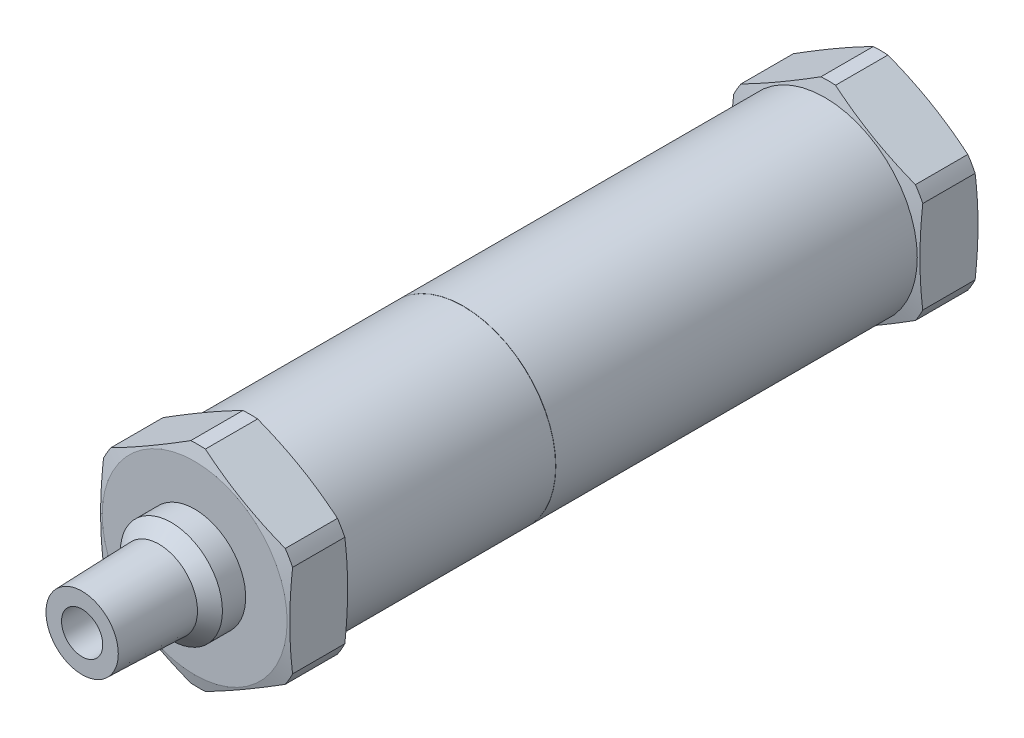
SolidWorks part; units mm, degrees
ref_plane "Front Plane" through (0, 0, 0) normal (0, 0, 1) x (1, 0, 0)
ref_plane "Top Plane" through (0, 0, 0) normal (0, 1, 0) x (1, 0, 0)
ref_plane "Right Plane" through (0, 0, 0) normal (1, 0, 0) x (0, 0, -1)
imported_body "Imported3"
sketch "Sketch1" plane through (0, 0, 92.583) normal (0, 0, 1) x (1, 0, 0)
  circle A0 centre (0, 0) radius 6.858
extrude "Boss-Extrude1" add sketch "Sketch1" along normal blind 3.1257
sketch "Sketch2" plane through (0, 0, 95.7087) normal (0, 0, 1) x (1, 0, 0)
  circle A0 centre (0, 0) radius 6.858
extrude "Boss-Extrude2" add sketch "Sketch2" along normal blind 1.6749 draft 45
sketch "Sketch3" plane through (0, 0, 97.3836) normal (0, 0, 1) x (1, 0, 0)
  circle A0 centre (0, 0) radius 5.1831
extrude "Boss-Extrude3" add sketch "Sketch3" along normal blind 10.3124 draft 1.8
hole_wizard "Hole1" positions "Sketch5" profile "Sketch4" legacy
sketch "Sketch5" plane through (0, 0, 0) normal (0, 0, -1) x (-1, 0, 0)
  point P0 (0, 0)
sketch "Sketch4" plane through (0, 0, 0) normal (1, 0, 0) x (0, 1, 0)
  line L0 (0, 0) -> (0, 8.001)
  line L1 (0, 8.001) -> (4.318, 8.001)
  line L2 (4.318, 8.001) -> (4.5666, 0)
  line L3 (4.5666, 0) -> (0, 0)
  line L4 (0, 110) -> (0, -10) construction
  dimension "Minor Diameter" = 8.636
  dimension "Depth" = 8.001
  dimension "Major Diameter" = 9.1333
hole_wizard "M5 Clearance Hole1" positions "Sketch7" profile "Sketch6" hole size "M5" standard "ANSI Metric"
sketch "Sketch7" plane through (0, 0, 107.696) normal (0, 0, 1) x (1, 0, 0)
  point P0 (0, 0)
sketch "Sketch6" plane through (0, 0, 107.696) normal (1, 0, 0) x (0, -1, 0)
  line L0 (0, 0) -> (0, 12.7)
  line L1 (0, 12.7) -> (2.7686, 12.7)
  line L2 (2.7686, 12.7) -> (2.7686, 0)
  line L5 (2.7686, 0) -> (0, 0)
  line L10 (0, 12.7) -> (-2.7686, 12.7) construction
  line L11 (0, -6.35) -> (0, 107.95) construction
  dimension "Hole Dia." = 5.5372
  dimension "Hole Depth" = 12.7
  dimension "Drill Angle" = 180
